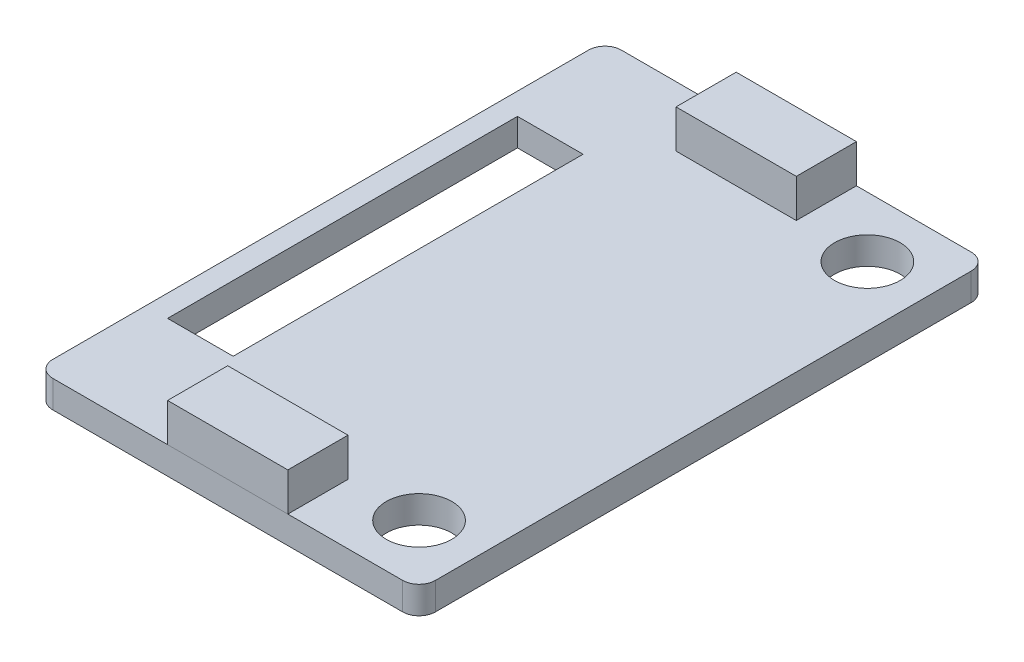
SolidWorks part; units mm, degrees
ref_plane "Front Plane" through (0, 0, 0) normal (0, 0, 1) x (1, 0, 0)
ref_plane "Top Plane" through (0, 0, 0) normal (0, 1, 0) x (1, 0, 0)
ref_plane "Right Plane" through (0, 0, 0) normal (1, 0, 0) x (0, 0, -1)
sketch "Sketch1" plane through (0, 0, 0) normal (0, 1, 0) x (1, 0, 0)
  line L0 (-55, 0) -> (55, 0) construction
  line L1 (-8.75, -13) -> (8.75, -13)
  line L2 (-8.75, -13) -> (-8.75, 13)
  line L3 (-8.75, 13) -> (8.75, 13)
  line L4 (8.75, -13) -> (8.75, 13)
  line L5 (-8.75, -13) -> (8.75, 13) construction
  line L6 (-8.75, 13) -> (8.75, -13) construction
  line L7 (-7.75, -8) -> (-4.75, -8)
  line L8 (-7.75, -8) -> (-7.75, 8)
  line L9 (-7.75, 8) -> (-4.75, 8)
  line L10 (-4.75, -8) -> (-4.75, 8)
  line L11 (-7.75, -8) -> (-4.75, 8) construction
  line L12 (-7.75, 8) -> (-4.75, -8) construction
  circle A0 centre (6, 10.25) radius 1.5
  circle A1 centre (6, -10.25) radius 1.5
  point P0 (0, 0)
  point P5 (-6.25, 0)
  dimension "D6" = 2.75
  dimension "D8" = 3
  dimension "D1" = 17.5
  dimension "D2" = 26
  dimension "D3" = 3
  dimension "D4" = 4
  dimension "D5" = 16
  dimension "D7" = 2.75
extrude "Boss-Extrude1" add sketch "Sketch1" along normal blind 1.25
fillet "Fillet1" radius 0.75 4 edges at (8.75, 0.625, -13) (-8.75, 0.625, -13) (-8.75, 0.625, 13) (8.75, 0.625, 13)
sketch "Sketch2" plane through (0, 1.25, 0) normal (0, 1, 0) x (1, 0, 0)
  line L0 (-8, -13) -> (8, -13) construction
  line L1 (-2.75, -13) -> (2.75, -13)
  line L2 (-2.75, -13) -> (-2.75, -10.25)
  line L3 (-2.75, -10.25) -> (2.75, -10.25)
  line L4 (2.75, -13) -> (2.75, -10.25)
  line L5 (-2.75, -13) -> (2.75, -10.25) construction
  line L6 (-2.75, -10.25) -> (2.75, -13) construction
  line L7 (-0.6875, 0) -> (0.6875, 0) construction
  line L8 (-2.75, 13) -> (2.75, 13)
  line L9 (2.75, 13) -> (2.75, 10.25)
  line L10 (-2.75, 13) -> (-2.75, 10.25)
  line L11 (-2.75, 10.25) -> (2.75, 10.25)
  point P0 (0, -11.625)
  point P7 (0, 0)
  dimension "D1" = 5.5
  dimension "D2" = 2.75
extrude "Boss-Extrude2" add sketch "Sketch2" along normal blind 1.75 separate body
